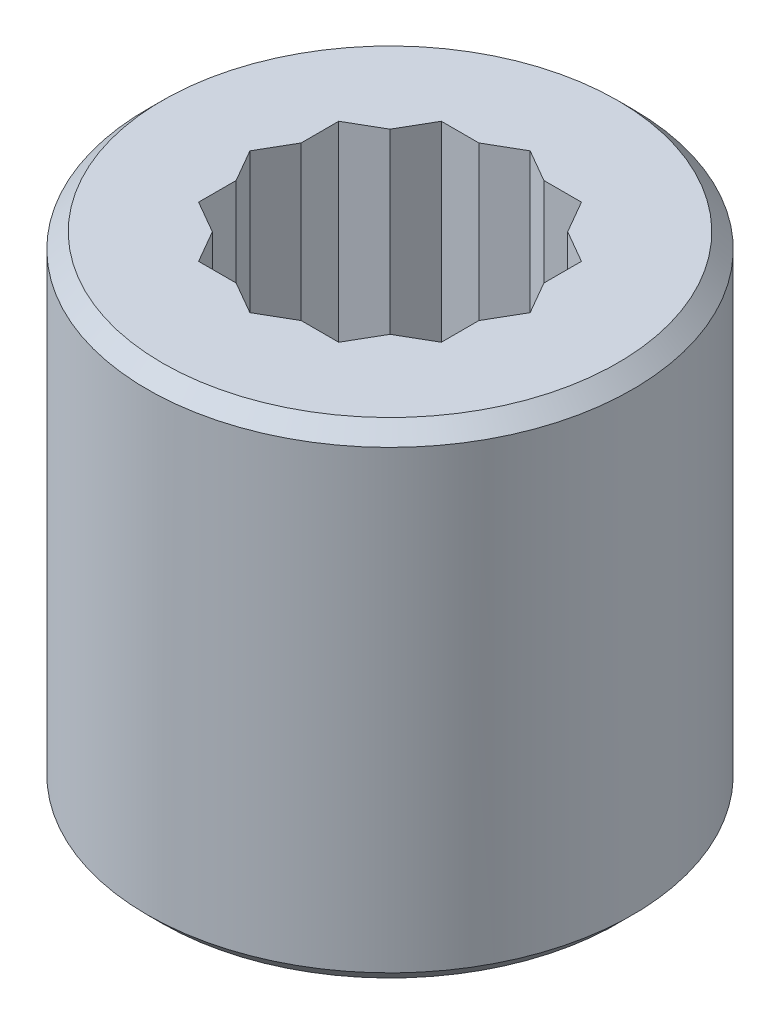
SolidWorks part; units mm, degrees
ref_plane "Front Plane" through (0, 0, 0) normal (0, 0, 1) x (1, 0, 0)
ref_plane "Top Plane" through (0, 0, 0) normal (0, 1, 0) x (1, 0, 0)
ref_plane "Right Plane" through (0, 0, 0) normal (1, 0, 0) x (0, 0, -1)
sketch "Sketch1" plane through (0, 0, 0) normal (0, 1, 0) x (1, 0, 0)
  circle A0 centre (0, 0) radius 12.7
  dimension "CylinderDiameter" = 25.4
extrude "Cylinder" add sketch "Sketch1" along normal blind 25.4
sketch "Sketch2" plane through (0, 25.4, 0) normal (0, 1, 0) x (-1, 0, 0)
  line L1 (-7.3323, 0) -> (-3.6662, -6.35)
  line L2 (-3.6662, -6.35) -> (3.6662, -6.35)
  line L3 (3.6662, -6.35) -> (7.3323, 0)
  line L4 (7.3323, 0) -> (3.6662, 6.35)
  line L5 (3.6662, 6.35) -> (-3.6662, 6.35)
  line L6 (-3.6662, 6.35) -> (-7.3323, 0)
  circle A0 centre (0, 0) radius 6.35 construction
  dimension "D1" = 12.7
extrude "6 Point" cut sketch "Sketch2" against normal blind 12.7
sketch "Sketch3" plane through (-3.872, 25.4, 9.385) normal (0, 1, 0) x (-1, 0, 0)
  line L1 (-10.222, -13.0512) -> (-3.872, -16.7173)
  line L2 (-3.872, -16.7173) -> (2.478, -13.0512)
  line L3 (2.478, -13.0512) -> (2.478, -5.7188)
  line L4 (2.478, -5.7188) -> (-3.872, -2.0526)
  line L5 (-3.872, -2.0526) -> (-10.222, -5.7188)
  line L6 (-10.222, -5.7188) -> (-10.222, -13.0512)
  line L7 (-3.872, -9.385) -> (-9.3713, -12.56) construction
  line L9 (-11.2044, -9.385) -> (-7.5382, -15.735) construction
  circle A0 centre (-3.872, -9.385) radius 6.35 construction
  circle A1 centre (-3.872, -9.385) radius 12.7 construction
  dimension "D1" = 12.7
extrude "12 Point" cut sketch "Sketch3" against normal up to surface (12.7 mm away)
sketch "Sketch4" plane through (0, 0, 0) normal (0, -1, 0) x (1, 0, 0)
  line L0 (-3.175, 3.175) -> (3.175, -3.175) construction
  line L1 (-3.175, 3.175) -> (3.175, 3.175)
  line L2 (-3.175, 3.175) -> (-3.175, -3.175)
  line L3 (-3.175, -3.175) -> (3.175, -3.175)
  line L4 (3.175, 3.175) -> (3.175, -3.175)
  dimension "DriveSquare" = 6.35
extrude "Drive" cut sketch "Sketch4" against normal up to next
chamfer "Chamfer1" distance 0.7937 angle 45 2 edges at (0, 0, 12.7) (0, 25.4, 12.7)
